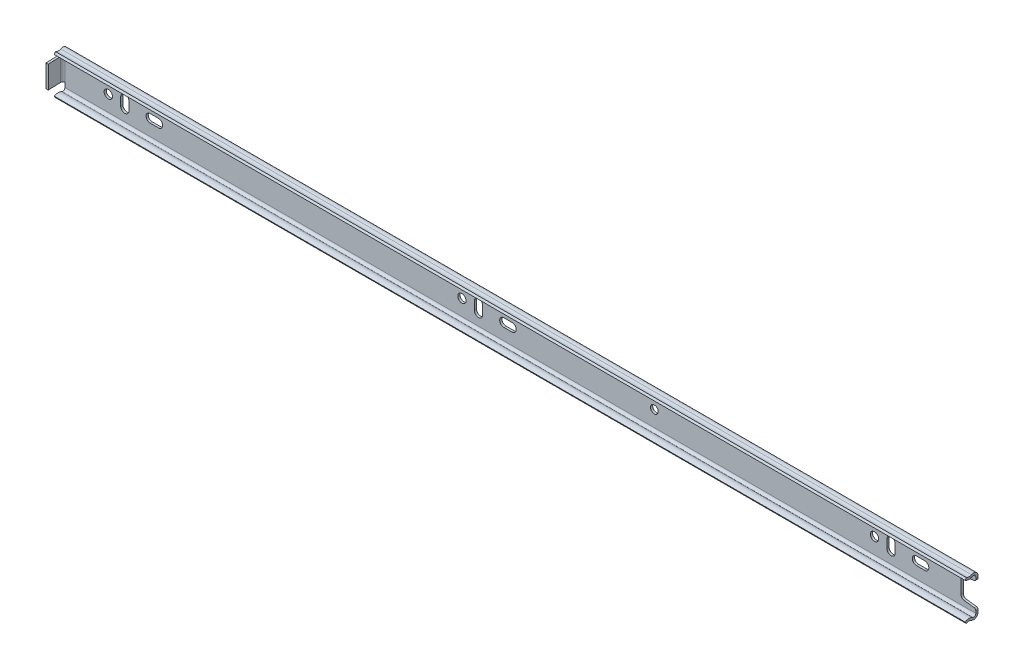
SolidWorks part; units mm, degrees
ref_plane "Front Plane" through (0, 0, 0) normal (0, 0, 1) x (1, 0, 0)
ref_plane "Top Plane" through (0, 0, 0) normal (0, 1, 0) x (1, 0, 0)
ref_plane "Right Plane" through (0, 0, 0) normal (1, 0, 0) x (0, 0, -1)
imported_body "Imported3"
sketch "Sketch2" plane through (-247.0993, 0, 0) normal (-1, 0, 0) x (0, 0, 1)
  line L0 (-1.2, -6.1) -> (-1.2, -8.6)
  line L1 (5.1618, -10.8162) -> (5.8, -9.8)
  line L2 (0, -8.6) -> (0, -6.1)
  line L3 (0, -6.1) -> (-1.2, -6.1)
  arc A0 (1.7654, -9.6584) -> (0, -8.6) centre (1.2, -8.6) cw
  spline S0 degree 2 poles (2.3308, -10.7169) (2.0615, -10.8608) (1.7642, -10.9327) (1.4573, -11.007) (1.1406, -10.9993) (0.825, -10.9915) (0.5212, -10.902) (0.2285, -10.8158) (-0.0341, -10.6584) (-0.2958, -10.5016) (-0.5106, -10.2834) (-0.7321, -10.0584) (-0.8883, -9.7828) (-1.044, -9.5081) (-1.1234, -9.2015) (-1.2, -8.9059) (-1.2, -8.6) knots 0 0 0 0.125 0.125 0.25 0.25 0.375 0.375 0.5 0.5 0.625 0.625 0.75 0.75 0.875 0.875 1 1 1
  spline S1 degree 3 poles (2.3308, -10.7169) (2.7397, -10.4985) (3.1964, -10.384) (3.6607, -10.384) knots 0 0 0 0 1 1 1 1
  spline S2 degree 3 poles (3.6607, -10.384) (4.1914, -10.384) (4.7118, -10.5336) (5.1618, -10.8162) knots 0 0 0 0 1 1 1 1
  spline S3 degree 2 poles (3.6607, -9.184) (4.2286, -9.184) (4.7738, -9.341) (5.3195, -9.4983) (5.8, -9.8) knots 0 0 0 0.5 0.5 1 1 1
  spline S4 degree 2 poles (1.7654, -9.6584) (2.203, -9.4247) (2.6838, -9.3044) (3.1651, -9.184) (3.6607, -9.184) knots 0 0 0 0.5 0.5 1 1 1
extrude "Cut-Extrude2" cut sketch "Sketch2" against normal blind 1.0993
sketch "Sketch3" plane through (0, 0, 0) normal (0, 0, 1) x (1, 0, 0)
  line L0 (248.5, 6.5) -> (240.5, 5.4468)
  line L1 (240.5, 5.4468) -> (240.5, -5.4468)
  line L2 (240.5, -5.4468) -> (248.5, -6.5)
  line L3 (248.5, -6.5) -> (248.5, 6.5)
extrude "Cut-Extrude3" cut sketch "Sketch3" against normal through all
sketch "Sketch4" plane through (0, 0, -1.2) normal (0, 0, -1) x (-1, 0, 0)
  line L0 (215.75, -2.25) -> (215.75, 2.25)
  line L1 (211.25, 2.25) -> (211.25, -2.25)
  arc A0 (215.75, 2.25) -> (211.25, 2.25) centre (213.5, 2.25) ccw
  arc A1 (211.25, -2.25) -> (215.75, -2.25) centre (213.5, -2.25) ccw
extrude "Cut-Extrude4" cut sketch "Sketch4" against normal through all
sketch "Sketch5" plane through (0, 0, -1.2) normal (0, 0, -1) x (-1, 0, 0)
  line L0 (199.75, 2.25) -> (195.25, 2.25)
  line L1 (195.25, -2.25) -> (199.75, -2.25)
  arc A0 (195.25, 2.25) -> (195.25, -2.25) centre (195.25, 0) ccw
  arc A1 (199.75, -2.25) -> (199.75, 2.25) centre (199.75, 0) ccw
extrude "Cut-Extrude5" cut sketch "Sketch5" against normal through all
sketch "Sketch6" plane through (0, 0, -1.2) normal (0, 0, -1) x (-1, 0, 0)
  line L0 (23.75, -2.25) -> (23.75, 2.25)
  line L1 (19.25, 2.25) -> (19.25, -2.25)
  arc A0 (23.75, 2.25) -> (19.25, 2.25) centre (21.5, 2.25) ccw
  arc A1 (19.25, -2.25) -> (23.75, -2.25) centre (21.5, -2.25) ccw
extrude "Cut-Extrude6" cut sketch "Sketch6" against normal through all
sketch "Sketch7" plane through (0, 0, -1.2) normal (0, 0, -1) x (-1, 0, 0)
  line L0 (7.75, 2.25) -> (3.25, 2.25)
  line L1 (3.25, -2.25) -> (7.75, -2.25)
  arc A0 (3.25, 2.25) -> (3.25, -2.25) centre (3.25, 0) ccw
  arc A1 (7.75, -2.25) -> (7.75, 2.25) centre (7.75, 0) ccw
extrude "Cut-Extrude7" cut sketch "Sketch7" against normal through all
sketch "Sketch8" plane through (0, 0, -1.2) normal (0, 0, -1) x (-1, 0, 0)
  line L0 (-200.25, -2.25) -> (-200.25, 2.25)
  line L1 (-204.75, 2.25) -> (-204.75, -2.25)
  arc A0 (-200.25, 2.25) -> (-204.75, 2.25) centre (-202.5, 2.25) ccw
  arc A1 (-204.75, -2.25) -> (-200.25, -2.25) centre (-202.5, -2.25) ccw
extrude "Cut-Extrude8" cut sketch "Sketch8" against normal through all
sketch "Sketch9" plane through (0, 0, 0) normal (0, 0, 1) x (1, 0, 0)
  line L0 (220.75, 2.25) -> (216.25, 2.25)
  line L1 (216.25, -2.25) -> (220.75, -2.25)
  arc A0 (216.25, 2.25) -> (216.25, -2.25) centre (216.25, 0) ccw
  arc A1 (220.75, -2.25) -> (220.75, 2.25) centre (220.75, 0) ccw
extrude "Cut-Extrude9" cut sketch "Sketch9" against normal through all
hole_wizard "Ø4.2 (4.2) Diameter Hole1" positions "Sketch11" profile "Sketch10" hole size "Ø4.2" standard "ANSI Metric"
sketch "Sketch11" plane through (0, 0, -1.2) normal (0, 0, -1) x (-1, 0, 0)
  point P0 (-74, 0)
sketch "Sketch10" plane through (74, 0, -1.2) normal (1, 0, 0) x (0, 1, 0)
  line L0 (0, 0) -> (0, 9.4943)
  line L1 (0, 9.4943) -> (2.1, 9.4943)
  line L2 (2.1, 9.4943) -> (2.1, 0)
  line L5 (2.1, 0) -> (0, 0)
  line L11 (0, -6.35) -> (0, 107.95) construction
  dimension "Thru Hole Dia." = 4.2
  dimension "Thru Hole Depth" = 9.4943
hole_wizard "Ø4.5 (4.5) Diameter Hole1" positions "Sketch13" profile "Sketch12" hole size "Ø4.5" standard "ANSI Metric"
sketch "Sketch13" plane through (0, 0, -1.2) normal (0, 0, -1) x (-1, 0, 0)
  point P0 (-193.5, 0)
  point P1 (30.5, 0)
  point P2 (222.5, 0)
sketch "Sketch12" plane through (193.5, 0, -1.2) normal (1, 0, 0) x (0, 1, 0)
  line L0 (0, 0) -> (0, 9.4943)
  line L1 (0, 9.4943) -> (2.25, 9.4943)
  line L2 (2.25, 9.4943) -> (2.25, 0)
  line L5 (2.25, 0) -> (0, 0)
  line L11 (0, -6.35) -> (0, 107.95) construction
  dimension "Thru Hole Dia." = 4.5
  dimension "Thru Hole Depth" = 9.4943
fillet "Fillet1" radius 1 2 edges at (248.5, -6.5, -0.6) (248.5, 6.5, -0.6)
fillet "Fillet2" radius 1.2 1 edges
fillet "Fillet3" radius 2 2 edges at (240.5, -5.4468, -0.6) (240.5, 5.4468, -0.6)
sketch "Sketch14" plane through (-247.0993, 0, 0) normal (-1, 0, 0) x (0, 0, 1)
  line L0 (0, 6.1) -> (-0.8535, 6.1) construction
  line L1 (7.6509, 11.2979) -> (-3.2325, 11.2979)
  line L2 (7.6509, 11.2979) -> (7.6509, 6.1)
  line L3 (7.6509, 6.1) -> (-3.2325, 6.1)
  line L4 (-3.2325, 11.2979) -> (-3.2325, 6.1)
extrude "Cut-Extrude10" cut sketch "Sketch14" against normal up to surface (1.0993 mm away)
